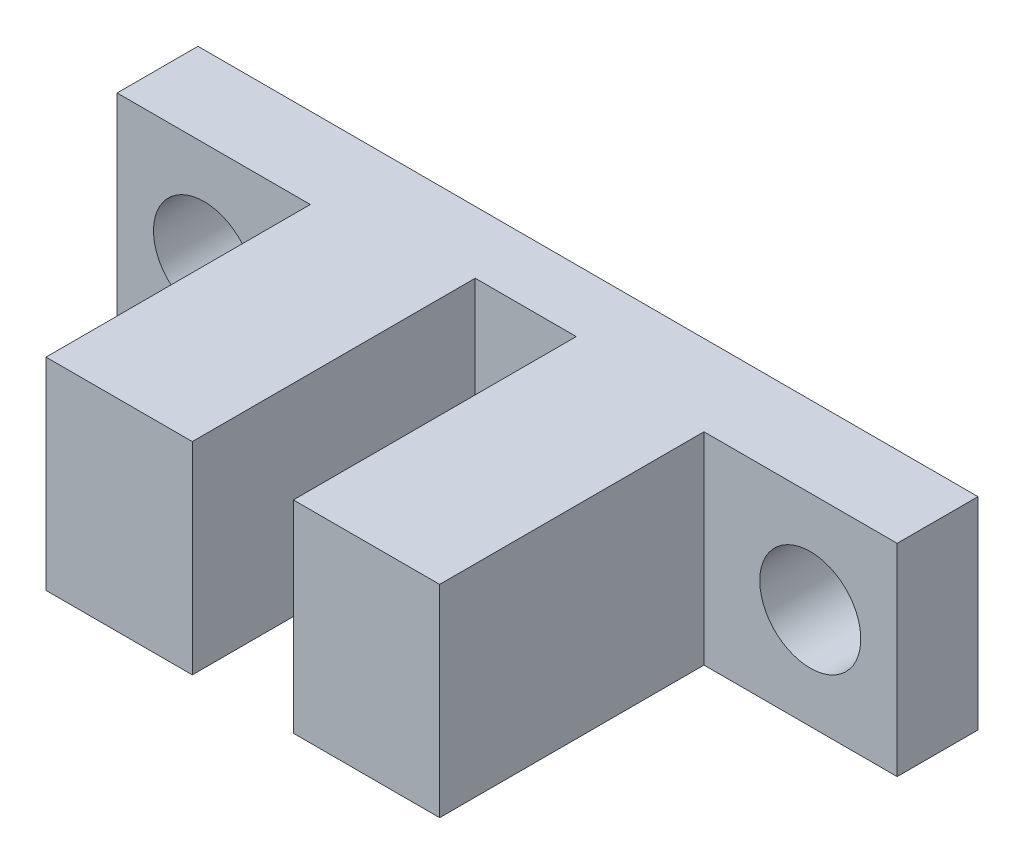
SolidWorks part; units mm, degrees
ref_plane "Front Plane" through (0, 0, 0) normal (0, 0, 1) x (1, 0, 0)
ref_plane "Top Plane" through (0, 0, 0) normal (0, 1, 0) x (1, 0, 0)
ref_plane "Right Plane" through (0, 0, 0) normal (1, 0, 0) x (0, 0, -1)
sketch "Sketch1" plane through (0, 0, 0) normal (0, 0, 1) x (1, 0, 0)
  line L1 (-12.2555, -3.175) -> (12.2555, -3.175)
  line L2 (-12.2555, -3.175) -> (-12.2555, 3.175)
  line L3 (-12.2555, 3.175) -> (12.2555, 3.175)
  line L4 (12.2555, -3.175) -> (12.2555, 3.175)
  line L5 (-12.2555, -3.175) -> (12.2555, 3.175) construction
  line L6 (-12.2555, 3.175) -> (12.2555, -3.175) construction
  point P0 (0, 0)
  dimension "D1" = 24.511
  dimension "D2" = 6.35
extrude "Boss-Extrude1" add sketch "Sketch1" along normal blind 2.54
sketch "Sketch2" plane through (0, 0, 2.54) normal (0, 0, 1) x (1, 0, 0)
  line L0 (12.2555, 3.175) -> (-12.2555, 3.175) construction
  line L1 (-6.1849, -3.175) -> (6.1849, -3.175)
  line L2 (-6.1849, -3.175) -> (-6.1849, 3.175)
  line L3 (-6.1849, 3.175) -> (6.1849, 3.175)
  line L4 (6.1849, -3.175) -> (6.1849, 3.175)
  line L5 (-6.1849, -3.175) -> (6.1849, 3.175) construction
  line L6 (-6.1849, 3.175) -> (6.1849, -3.175) construction
  point P0 (0, 0)
  dimension "D1" = 12.3698
extrude "Boss-Extrude2" add sketch "Sketch2" along normal blind 8.3058
sketch "Sketch3" plane through (0, 0, 10.8458) normal (0, 0, 1) x (1, 0, 0)
  line L0 (-6.1849, -3.175) -> (6.1849, -3.175) construction
  line L1 (-1.5875, 3.175) -> (1.5875, 3.175)
  line L2 (-1.5875, 3.175) -> (-1.5875, -3.175)
  line L3 (-1.5875, -3.175) -> (1.5875, -3.175)
  line L4 (1.5875, 3.175) -> (1.5875, -3.175)
  line L5 (-1.5875, 3.175) -> (1.5875, -3.175) construction
  line L6 (-1.5875, -3.175) -> (1.5875, 3.175) construction
  point P0 (0, 0)
  dimension "D1" = 3.175
extrude "Cut-Extrude1" cut sketch "Sketch3" against normal blind 8.89
sketch "Sketch4" plane through (0, 0, 0) normal (0, 0, -1) x (-1, 0, 0)
  line L0 (9.525, 0) -> (-9.525, 0) construction
  circle A0 centre (9.525, 0) radius 1.5875
  circle A1 centre (-9.525, 0) radius 1.5875
  point P2 (0, 0)
  dimension "D2" = 3.175
  dimension "D1" = 19.05
extrude "Cut-Extrude2" cut sketch "Sketch4" against normal through all
